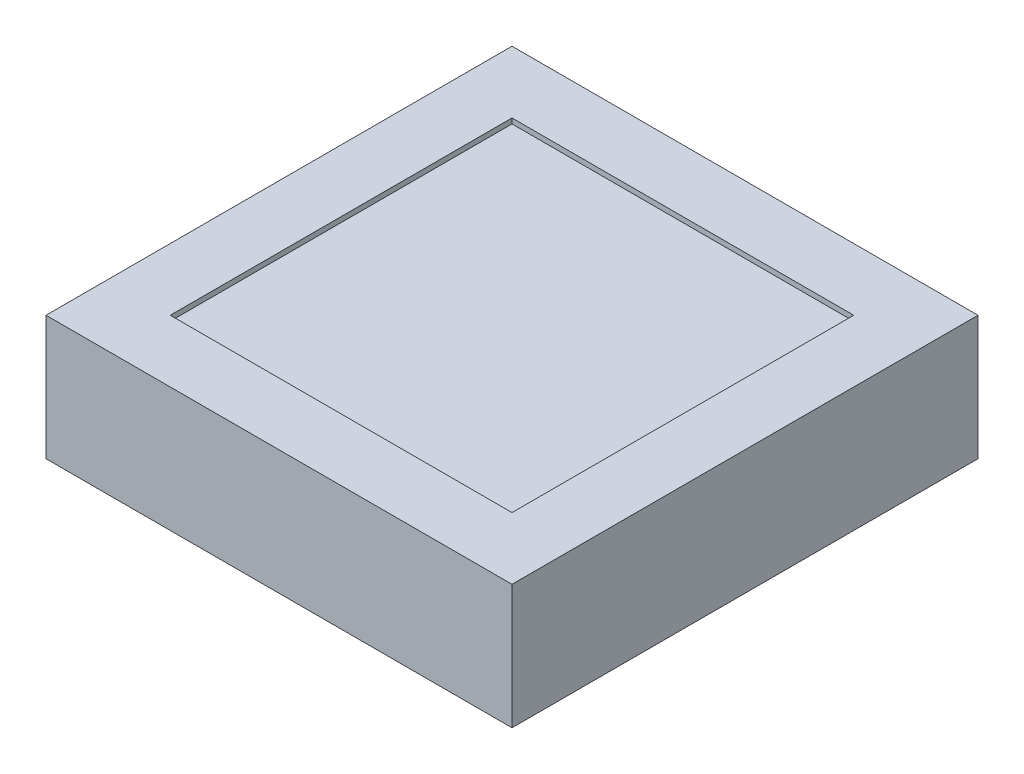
SolidWorks part; units mm, degrees
ref_plane "Alzado" through (0, 0, 0) normal (0, 0, 1) x (1, 0, 0)
ref_plane "Planta" through (0, 0, 0) normal (0, 1, 0) x (1, 0, 0)
ref_plane "Vista lateral" through (0, 0, 0) normal (1, 0, 0) x (0, 0, -1)
sketch "Croquis1" plane through (0, 0, 0) normal (0, 1, 0) x (1, 0, 0)
  line L1 (54.1435, -145.2549) -> (144.1435, -145.2549)
  line L2 (54.1435, -145.2549) -> (54.1435, -55.2549)
  line L3 (54.1435, -55.2549) -> (144.1435, -55.2549)
  line L4 (144.1435, -145.2549) -> (144.1435, -55.2549)
  line L5 (54.1435, -145.2549) -> (144.1435, -55.2549) construction
  line L6 (54.1435, -55.2549) -> (144.1435, -145.2549) construction
  dimension "D1" = 90
  dimension "D2" = 90
extrude "Saliente-Extruir1" add sketch "Croquis1" along normal blind 24
sketch "Croquis3" plane through (0, 24, 0) normal (0, 1, 0) x (1, 0, 0)
  line L0 (144.1435, -145.2549) -> (144.1435, -55.2549) construction
  line L1 (66.1435, -133.2549) -> (132.1435, -133.2549)
  line L2 (66.1435, -133.2549) -> (66.1435, -67.2549)
  line L3 (66.1435, -67.2549) -> (132.1435, -67.2549)
  line L4 (132.1435, -133.2549) -> (132.1435, -67.2549)
  line L5 (66.1435, -133.2549) -> (132.1435, -67.2549) construction
  line L6 (66.1435, -67.2549) -> (132.1435, -133.2549) construction
  line L7 (144.1435, -55.2549) -> (54.1435, -55.2549) construction
  line L8 (54.1435, -55.2549) -> (54.1435, -145.2549) construction
  line L9 (54.1435, -145.2549) -> (144.1435, -145.2549) construction
  point P0 (99.1435, -100.2549)
  dimension "D1" = 12
  dimension "D2" = 12
  dimension "D3" = 12
  dimension "D4" = 12
extrude "Cortar-Extruir2" cut sketch "Croquis3" against normal blind 1
